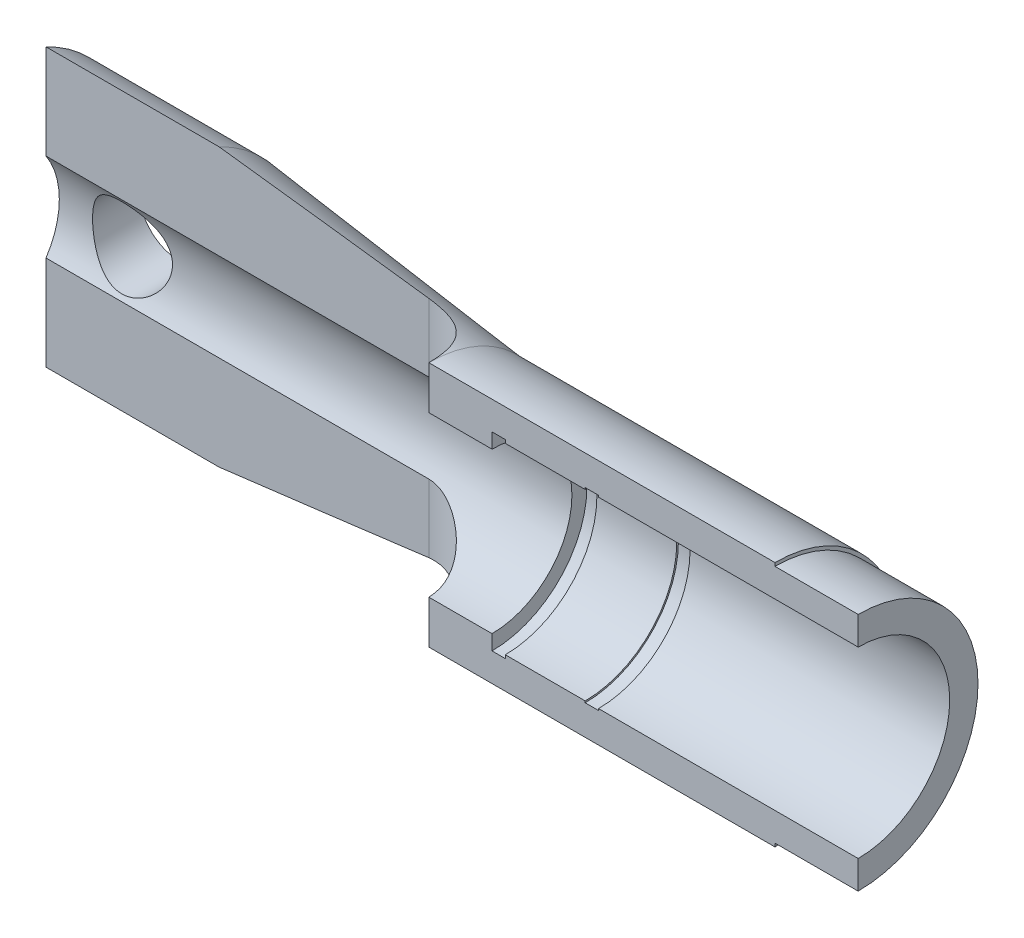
SolidWorks part; units mm, degrees
ref_plane "Plan de face" through (0, 0, 0) normal (0, 0, 1) x (1, 0, 0)
ref_plane "Plan de dessus" through (0, 0, 0) normal (0, 1, 0) x (1, 0, 0)
ref_plane "Plan de droite" through (0, 0, 0) normal (1, 0, 0) x (0, 0, -1)
sketch "Esquisse1" plane through (0, 0, 0) normal (0, 0, 1) x (1, 0, 0)
  line L0 (0, 36) -> (0, 27.5)
  line L1 (0, 27.5) -> (-78, 27.5)
  line L2 (-78, 27.5) -> (-78, 28)
  line L3 (-78, 28) -> (-82, 28)
  line L4 (-82, 28) -> (-82, 27.5)
  line L5 (-82, 27.5) -> (-106, 27.5)
  line L6 (-106, 27.5) -> (-106, 28.5)
  line L7 (-106, 28.5) -> (-110, 28.5)
  line L8 (-110, 28.5) -> (-110, 24)
  line L9 (-110, 24) -> (-264, 24)
  line L10 (-264, 46.2222) -> (-264, 24)
  line L11 (-192, 44) -> (-129, 37)
  line L12 (-129, 37) -> (-25, 37)
  line L13 (0, 0) -> (-194.9939, 0) construction
  line L14 (-25, 37) -> (-25, 36)
  line L15 (0, 36) -> (-25, 36)
  line L16 (-192, 88.33) -> (-192, -33.534) construction
  line L17 (-231.6925, 44) -> (-142.5097, 44) construction
  line L18 (-192, 44) -> (-212, 46.2222)
  line L19 (-212, 81.3923) -> (-212, -12.7309) construction
  line L20 (-212, 46.2222) -> (-264, 46.2222)
  dimension "D1" = 27.5
  dimension "D2" = 36
  dimension "D3" = 25
  dimension "D4" = 37
  dimension "D5" = 104
  dimension "D6" = 192
  dimension "D7" = 44
  dimension "D8" = 264
  dimension "D9" = 78
  dimension "D10" = 4
  dimension "D11" = 28
  dimension "D12" = 24
  dimension "D13" = 4
  dimension "D14" = 1
  dimension "D15" = 24
  dimension "D16" = 52
revolve "Révolution1" add sketch "Esquisse1" angle 180 about L13
sketch "Esquisse2" plane through (0, 0, 0) normal (0, 1, 0) x (1, 0, 0)
  line L3 (-212, 0) -> (-264, 0) construction
  line L4 (-129, 0) -> (-212, 0) construction
  line L5 (-264, 0) -> (-264, 20)
  line L6 (-212, 0) -> (-264, 0)
  line L7 (-129, 0) -> (-212, 0)
  line L8 (-124, 54.5184) -> (-124, -16.398) construction
  line L9 (-264, 46.2222) -> (-264, 0) construction
  line L10 (-264, 20) -> (-149, 20)
  arc A0 (-129, 0) -> (-149, 20) centre (-149, 0) ccw
  dimension "D1" = 20
extrude "Enlèv. mat.-Extru.1" cut sketch "Esquisse2" against normal through all and the other way through all
sketch "Esquisse3" plane through (0, 0, 0) normal (0, 0, 1) x (1, 0, 0)
  circle A0 centre (-242, 0) radius 12
  dimension "D1" = 24
  dimension "D2" = 242
extrude "Enlèv. mat.-Extru.2" cut sketch "Esquisse3" against normal up to surface (48.2222 mm away)
sketch "Esquisse4" plane through (-264, 0, 0) normal (-1, 0, 0) x (0, 0, 1)
  line L1 (-70.8073, 43.6817) -> (-38, 43.6817)
  line L2 (-70.8073, 43.6817) -> (-70.8073, -43.6817)
  line L3 (-70.8073, -43.6817) -> (-38, -43.6817)
  line L4 (-38, 43.6817) -> (-38, -43.6817)
  dimension "D1" = 38
extrude "Enlèv. mat.-Extru.3" cut sketch "Esquisse4" against normal blind 37
